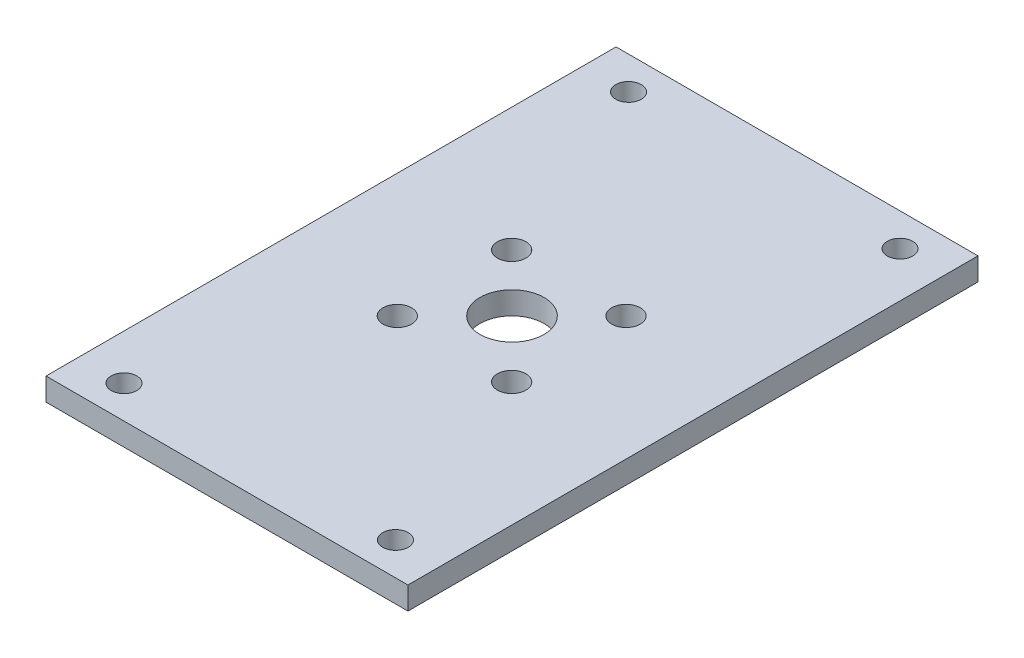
SolidWorks part; units mm, degrees
ref_plane "Front Plane" through (0, 0, 0) normal (0, 0, 1) x (1, 0, 0)
ref_plane "Top Plane" through (0, 0, 0) normal (0, 1, 0) x (1, 0, 0)
ref_plane "Right Plane" through (0, 0, 0) normal (1, 0, 0) x (0, 0, -1)
sketch "Sketch1" plane through (0, 0, 0) normal (0, 1, 0) x (1, 0, 0)
  line L6 (-25.4, 40.005) -> (-25.4, -40.005)
  line L7 (-25.4, 40.005) -> (25.4, 40.005)
  line L13 (25.4, -40.005) -> (-25.4, -40.005)
  line L18 (25.4, 40.005) -> (25.4, -40.005)
  point P0 (0, 40.005)
  point P1 (-25.4, 0)
  dimension "D1" = 80.01
  dimension "D2" = 50.8
sketch "Sketch2" plane through (0, 0, 0) normal (0, 1, 0) x (1, 0, 0)
  line L0 (0, 0) -> (4.1755, 0) construction
  line L2 (0, 0) -> (8, 8) construction
  circle A1 centre (8, 8) radius 2
  point P4 (0, 0)
  dimension "D1" = 11.3137
  dimension "D2" = 4
  dimension "D3" = 45
extrude "Boss-Extrude1" add sketch "Sketch1" along normal blind 3.175
extrude "Cut-Extrude2" cut sketch "Sketch2" along normal through all
pattern_circular "CirPattern1" count 4 over 360 about axis through (-0.0248, 0, 0.0248) along (0, 1, 0) of "Cut-Extrude2"
sketch "Sketch3" plane through (0, 0, 0) normal (0, 1, 0) x (1, 0, 0)
  line L2 (25.4, 40.005) -> (-25.4, 40.005) construction
  line L3 (-25.4, 40.005) -> (-25.4, -40.005) construction
  line L4 (25.4, -40.005) -> (25.4, 40.005) construction
  circle A0 centre (-19.05, 35.4076) radius 1.7907
  circle A1 centre (19.05, 35.4076) radius 1.7907
  dimension "D1" = 3.5814
  dimension "D2" = 6.35
  dimension "D3" = 4.5974
  dimension "D4" = 6.35
  dimension "D5" = 4.5974
extrude "Cut-Extrude7" cut sketch "Sketch3" along normal up to surface (3.175 mm away)
sketch "Sketch5" plane through (0, 0, 0) normal (0, 1, 0) x (1, 0, 0)
  circle A0 centre (0, 0) radius 4.5
  dimension "D1" = 9
extrude "Cut-Extrude8" cut sketch "Sketch5" along normal up to surface (3.175 mm away)
pattern_circular "CirPattern2" count 4 over 360 about axis through (0, 3.175, 0) along (0, -1, 0) of "Cut-Extrude7"
